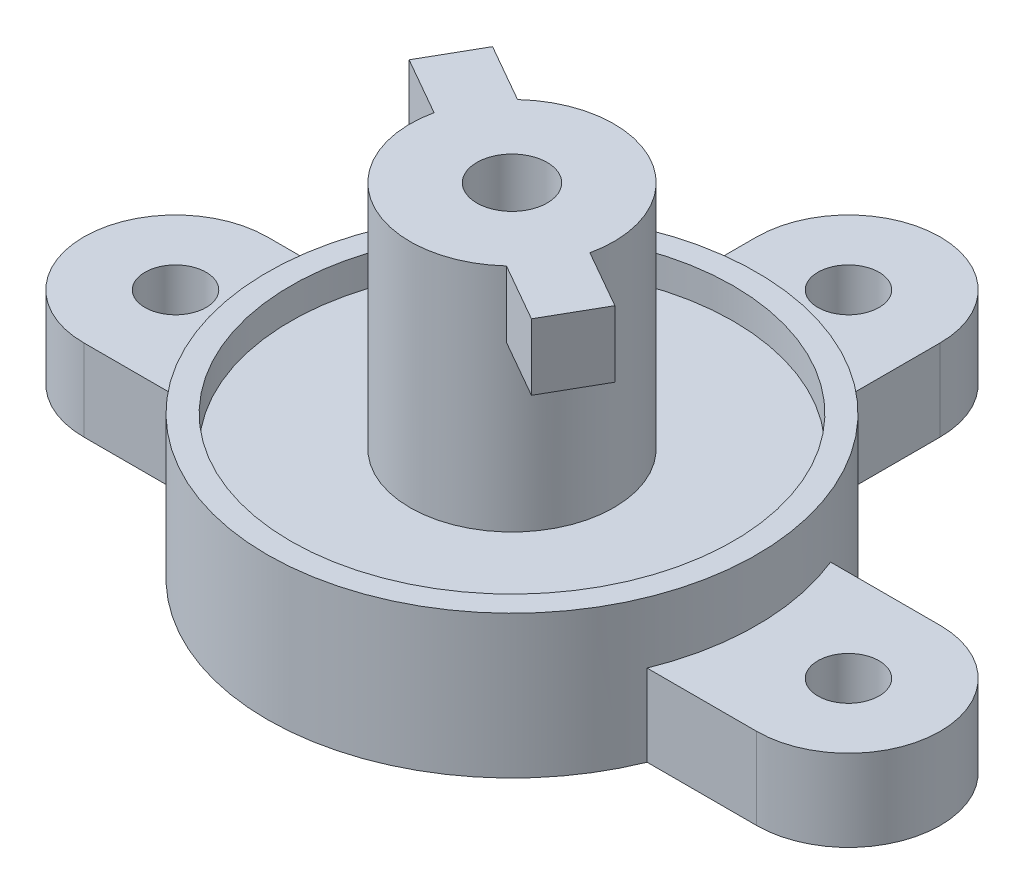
SolidWorks part; units mm, degrees
ref_plane "Front Plane" through (0, 0, 0) normal (0, 0, 1) x (1, 0, 0)
ref_plane "Top Plane" through (0, 0, 0) normal (0, 1, 0) x (1, 0, 0)
ref_plane "Right Plane" through (0, 0, 0) normal (1, 0, 0) x (0, 0, -1)
body saved out of another part "Stock-hemispherical_feet_or_front_side_only_base-1"
